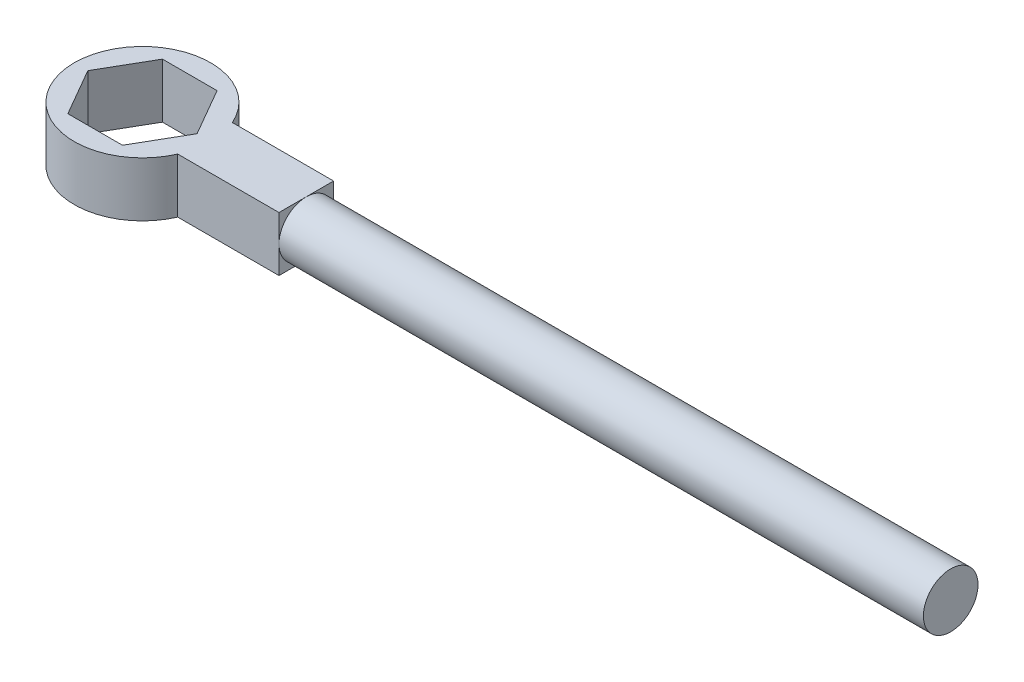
SolidWorks part; units mm, degrees
ref_plane "Front Plane" through (0, 0, 0) normal (0, 0, 1) x (1, 0, 0)
ref_plane "Top Plane" through (0, 0, 0) normal (0, 1, 0) x (1, 0, 0)
ref_plane "Right Plane" through (0, 0, 0) normal (1, 0, 0) x (0, 0, -1)
sketch "Sketch1" plane through (0, 0, 0) normal (0, 1, 0) x (1, 0, 0)
  line L1 (1, 0) -> (0.5, 0.866)
  line L2 (0.5, 0.866) -> (-0.5, 0.866)
  line L3 (-0.5, 0.866) -> (-1, 0)
  line L4 (-1, 0) -> (-0.5, -0.866)
  line L5 (-0.5, -0.866) -> (0.5, -0.866)
  line L6 (0.5, -0.866) -> (1, 0)
  circle A0 centre (0, 0) radius 1.25
  circle A1 centre (0, 0) radius 1 construction
  dimension "D1" = 2.5
  dimension "D2" = 2
extrude "Boss-Extrude1" add sketch "Sketch1" along normal blind 1
ref_plane "Plane1" through (1.5, 0, 0) normal (1, 0, 0) x (0, 0, -1)
sketch "Sketch2" plane through (1.5, 0, 0) normal (1, 0, 0) x (0, 0, -1)
  circle A0 centre (0, 0.5) radius 0.5
  dimension "D1" = 1
extrude "Boss-Extrude2" add sketch "Sketch2" along normal blind 13.3 and the other way up to surface separate body
sketch "Sketch3" plane through (1.5, 0, 0) normal (1, 0, 0) x (0, 0, -1)
  line L0 (1.25, 1) -> (-1.25, 1) construction
  line L1 (0.5, 0) -> (-0.5, 0)
  line L2 (0.5, 0) -> (0.5, 1)
  line L3 (0.5, 1) -> (-0.5, 1)
  line L4 (-0.5, 0) -> (-0.5, 1)
  line L5 (0.5, 0) -> (-0.5, 1) construction
  line L6 (0.5, 1) -> (-0.5, 0) construction
  point P0 (0, 0.5)
extrude "Boss-Extrude3" add sketch "Sketch3" along normal blind 1.5 and the other way up to surface
